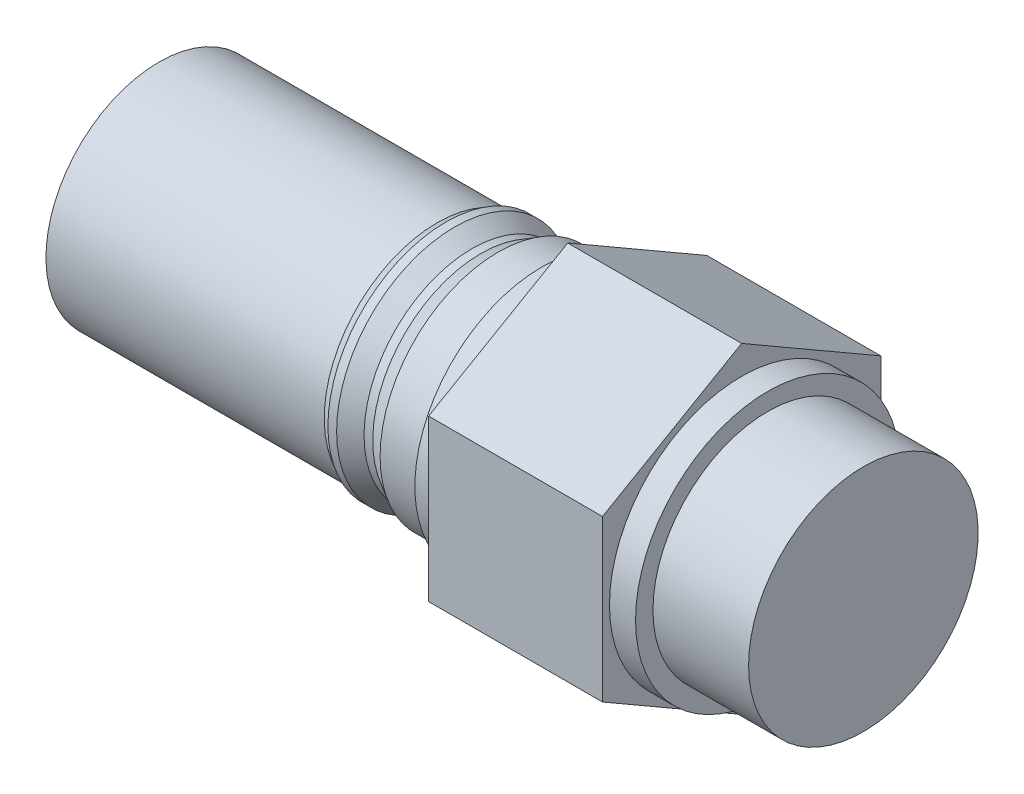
SolidWorks part; units mm, degrees
ref_plane "Alzado" through (0, 0, 0) normal (0, 0, 1) x (1, 0, 0)
ref_plane "Planta" through (0, 0, 0) normal (0, 1, 0) x (1, 0, 0)
ref_plane "Vista lateral" through (0, 0, 0) normal (1, 0, 0) x (0, 0, -1)
sketch "Croquis1" plane through (0, 0, 0) normal (0, 0, 1) x (1, 0, 0)
  line L0 (0, 0) -> (47, 0) construction
  line L1 (0, 0) -> (0, 13)
  line L2 (0, 13) -> (32, 13)
  line L3 (32, 13) -> (33, 13.5774)
  line L4 (33, 13.5774) -> (34, 13.5774)
  line L5 (33.5, 13.5774) -> (33.5, 0) construction
  line L6 (35, 13) -> (34, 13.5774)
  line L7 (35, 13) -> (36, 12.4226)
  line L8 (36, 12.4226) -> (37, 12.4226)
  line L9 (36.5, 12.4226) -> (36.5, 0) construction
  line L10 (38, 13) -> (37, 12.4226)
  line L11 (38, 13) -> (39, 13.5774)
  line L12 (39, 13.5774) -> (44, 13.5774)
  line L14 (47, 0) -> (0, 0)
  line L15 (44, 13.5774) -> (44, 14.5774)
  line L16 (44, 14.5774) -> (47, 14.5774)
  line L17 (47, 14.5774) -> (47, 0)
  point P18 (27.5743, 0)
  dimension "D1" = 26
  dimension "D2" = 32
  dimension "D3" = 1
  dimension "D4" = 1
  dimension "D5" = 150
  dimension "D6" = 1
  dimension "D7" = 1
  dimension "D8" = 5
  dimension "D9" = 1
  dimension "D10" = 3
revolve "Revolución1" add sketch "Croquis1" angle 360 about L14
sketch "Croquis8" plane through (47, 0, 0) normal (1, 0, 0) x (0, 0, -1)
  line L1 (0, 18.4752) -> (-16, 9.2376)
  line L2 (-16, 9.2376) -> (-16, -9.2376)
  line L3 (-16, -9.2376) -> (0, -18.4752)
  line L4 (0, -18.4752) -> (16, -9.2376)
  line L5 (16, -9.2376) -> (16, 9.2376)
  line L6 (16, 9.2376) -> (0, 18.4752)
  circle A0 centre (0, 0) radius 16 construction
  dimension "D1" = 32
extrude "Saliente-Extruir6" add sketch "Croquis8" along normal blind 20
sketch "Croquis10" plane through (0, 0, 0) normal (0, 0, 1) x (1, 0, 0)
  line L0 (67, 0) -> (81, 0) construction
  line L1 (67, 9.2376) -> (67, -9.2376) construction
  line L2 (81, 0) -> (81, 13.2)
  line L3 (81, 13.2) -> (70, 13.2)
  line L4 (70, 13.2) -> (70, 15.2)
  line L5 (70, 15.2) -> (67, 15.2)
  line L6 (67, 15.2) -> (67, 0)
  line L7 (67, 0) -> (81, 0)
  line L8 (67, 0) -> (108.8542, 0) construction
  dimension "D1" = 14
  dimension "D2" = 3
  dimension "D3" = 26.4
  dimension "D4" = 2
revolve "Revolución3" add sketch "Croquis10" angle 360 about L8
